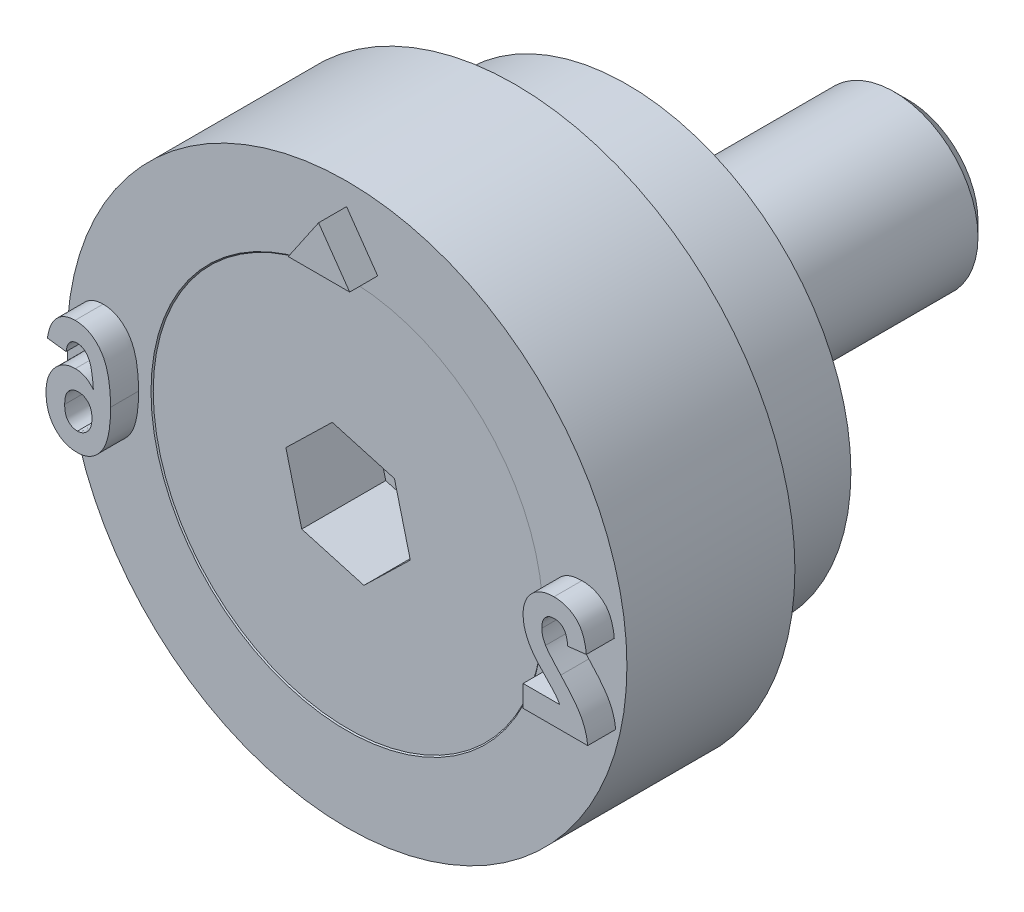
SolidWorks part; units mm, degrees
other "<M3 X .5 FHCS>-<Imported1>"
ref_plane "Front Plane" through (0, 0, 0) normal (0, 0, 1) x (1, 0, 0)
ref_plane "Top Plane" through (0, 0, 0) normal (0, 1, 0) x (1, 0, 0)
ref_plane "Right Plane" through (0, 0, 0) normal (1, 0, 0) x (0, 0, -1)
imported_body "Imported1"
sketch "Sketch1" plane through (0, 0, 0) normal (0, 0, 1) x (1, 0, 0)
  line L0 (-0.0071, 4.6037) -> (-0.5487, 3.81)
  line L1 (-0.5487, 3.81) -> (0.5487, 3.81)
  line L2 (0.5487, 3.81) -> (-0.0071, 4.6037)
  text T0 "2             6" font "Arial" height 2
  dimension "D1" = 1.0795
  dimension "D2" = 4.9022
extrude "Boss-Extrude1" add sketch "Sketch1" along normal blind 0.5 and the other way up to surface
inserted part "M3 X .5 FHCS"
move or copy body "Body-Move/Copy2" placed by mates yes
